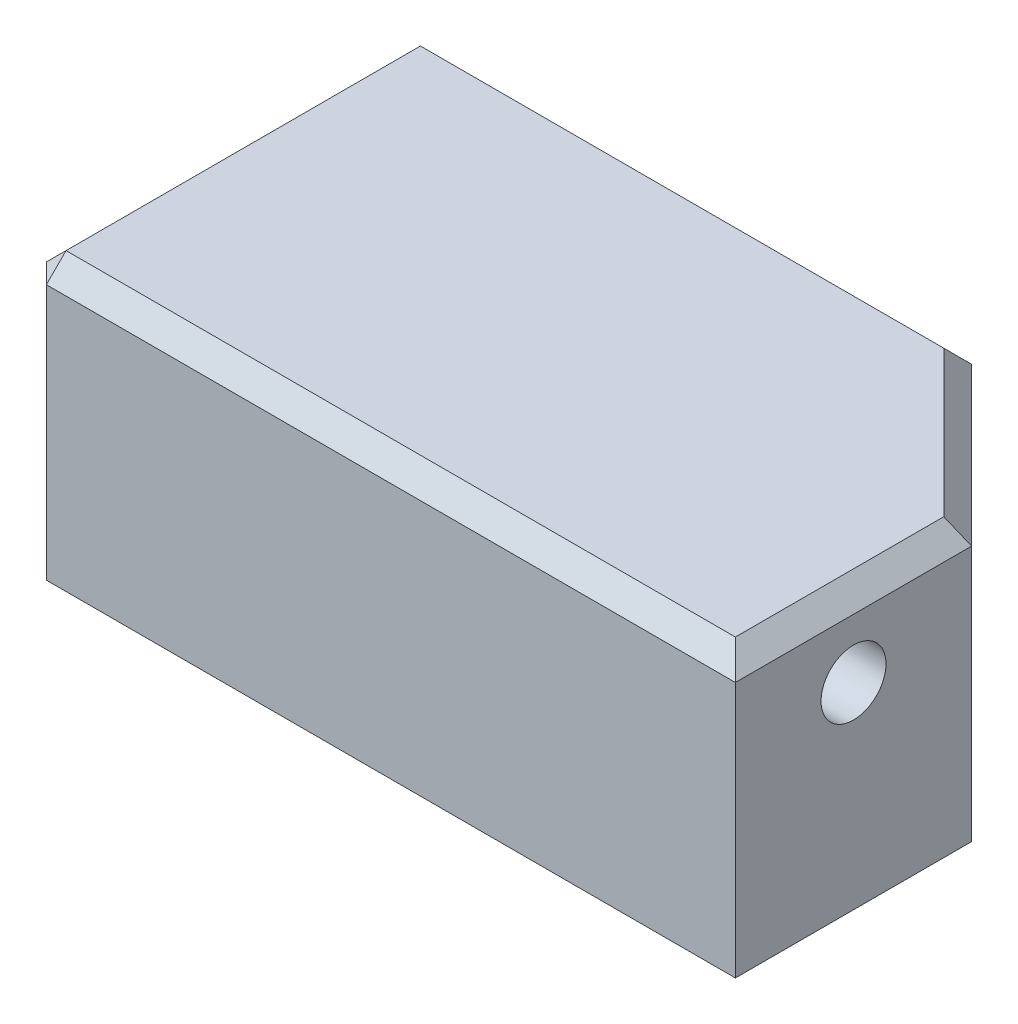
SolidWorks part; units mm, degrees
ref_plane "Front Plane" through (0, 0, 0) normal (0, 0, 1) x (1, 0, 0)
ref_plane "Top Plane" through (0, 0, 0) normal (0, 1, 0) x (1, 0, 0)
ref_plane "Right Plane" through (0, 0, 0) normal (1, 0, 0) x (0, 0, -1)
sketch "Sketch1" plane through (0, 0, 0) normal (0, 1, 0) x (1, 0, 0)
  line L0 (0, 0) -> (0, 10)
  line L1 (0, 10) -> (14, 10)
  line L2 (14, 10) -> (18, 6)
  line L3 (18, 6) -> (18, 0)
  line L4 (18, 0) -> (0, 0)
  dimension "D1" = 18
  dimension "D2" = 10
  dimension "D3" = 6
  dimension "D4" = 14
  dimension "D5" = 5.6569
  dimension "D6" = 135
extrude "Boss-Extrude1" add sketch "Sketch1" along normal blind 7
hole_wizard "Ø1.65 (1.65) Diameter Hole1" positions "Sketch3" profile "Sketch2" hole size "Ø1.65" standard "ISO"
sketch "Sketch3" plane through (18, 0, 0) normal (1, 0, 0) x (0, 0, -1)
  line L0 (0, 7) -> (0, 0) construction
  line L1 (0, 0) -> (6, 0) construction
  point P0 (3, 5)
  dimension "D1" = 3
  dimension "D2" = 5
sketch "Sketch2" plane through (18, 5, -3) normal (0, 1, 0) x (0, 0, -1)
  line L0 (0, 0) -> (0, 15.825)
  line L1 (0, 15.825) -> (0.825, 15)
  line L2 (0.825, 15) -> (0.825, 0)
  line L5 (0.825, 0) -> (0, 0)
  line L10 (0, 15.825) -> (-0.825, 15) construction
  line L11 (0, -6.35) -> (0, 107.95) construction
  dimension "Hole Dia." = 1.65
  dimension "Hole Depth" = 15
  dimension "Drill Angle" = 90
hole_wizard "Ø1.65 (1.65) Diameter Hole2" positions "Sketch5" profile "Sketch4" hole size "Ø1.65" standard "ISO"
sketch "Sketch5" plane through (0, 0, -10) normal (0, 0, -1) x (-1, 0, 0)
  line L0 (0, 7) -> (0, 0) construction
  line L1 (-14, 0) -> (0, 0) construction
  line L2 (-14, 7) -> (-14, 0) construction
  point P0 (-3, 5)
  point P7 (-11, 5)
  dimension "D1" = 3
  dimension "D2" = 5
  dimension "D3" = 5
  dimension "D4" = 3
sketch "Sketch4" plane through (3, 5, -10) normal (1, 0, 0) x (0, 1, 0)
  line L0 (0, 0) -> (0, 7.825)
  line L1 (0, 7.825) -> (0.825, 7)
  line L2 (0.825, 7) -> (0.825, 0)
  line L5 (0.825, 0) -> (0, 0)
  line L10 (0, 7.825) -> (-0.825, 7) construction
  line L11 (0, -6.35) -> (0, 107.95) construction
  dimension "Hole Dia." = 1.65
  dimension "Hole Depth" = 7
  dimension "Drill Angle" = 90
hole_wizard "M1.6 Tapped Hole1" positions "Sketch9" profile "Sketch8" tap size "M1.6" standard "ISO"
sketch "Sketch9" plane through (0, 0, 0) normal (0, -1, 0) x (-1, 0, 0)
  line L0 (-14, 10) -> (0, 10) construction
  line L1 (0, 10) -> (0, 0) construction
  line L2 (-18, 0) -> (-18, 6) construction
  line L3 (0, 0) -> (-18, 0) construction
  point P0 (-7, 7)
  point P2 (-15, 7)
  point P5 (-7, 10)
  point P15 (-1.5, 1.5)
  point P17 (-15, 1.5)
  dimension "D1" = 3
  dimension "D2" = 7
  dimension "D3" = 3
  dimension "D4" = 7
  dimension "D5" = 1.5
  dimension "D6" = 1.5
  dimension "D7" = 1.5
  dimension "D8" = 3
sketch "Sketch8" plane through (7, 0, -7) normal (1, 0, 0) x (0, 0, -1)
  line L0 (0, 0) -> (0, 3.8755)
  line L1 (0, 3.8755) -> (0.625, 3.5)
  line L2 (0.625, 3.5) -> (0.625, 0)
  line L5 (0.625, 0) -> (0, 0)
  line L10 (0, 3.8755) -> (-0.625, 3.5) construction
  line L11 (0, -6.35) -> (0, 107.95) construction
  dimension "Tap Drill Dia." = 1.25
  dimension "Tap Drill Depth" = 3.5
  dimension "Drill Angle" = 118
chamfer "Chamfer1" distance 0.5 angle 45 6 edges at (18, 7, -3) (16, 7, -8) (7, 7, -10) (9, 7, 0) (0, 7, -5) (0, 3.5, 0)
